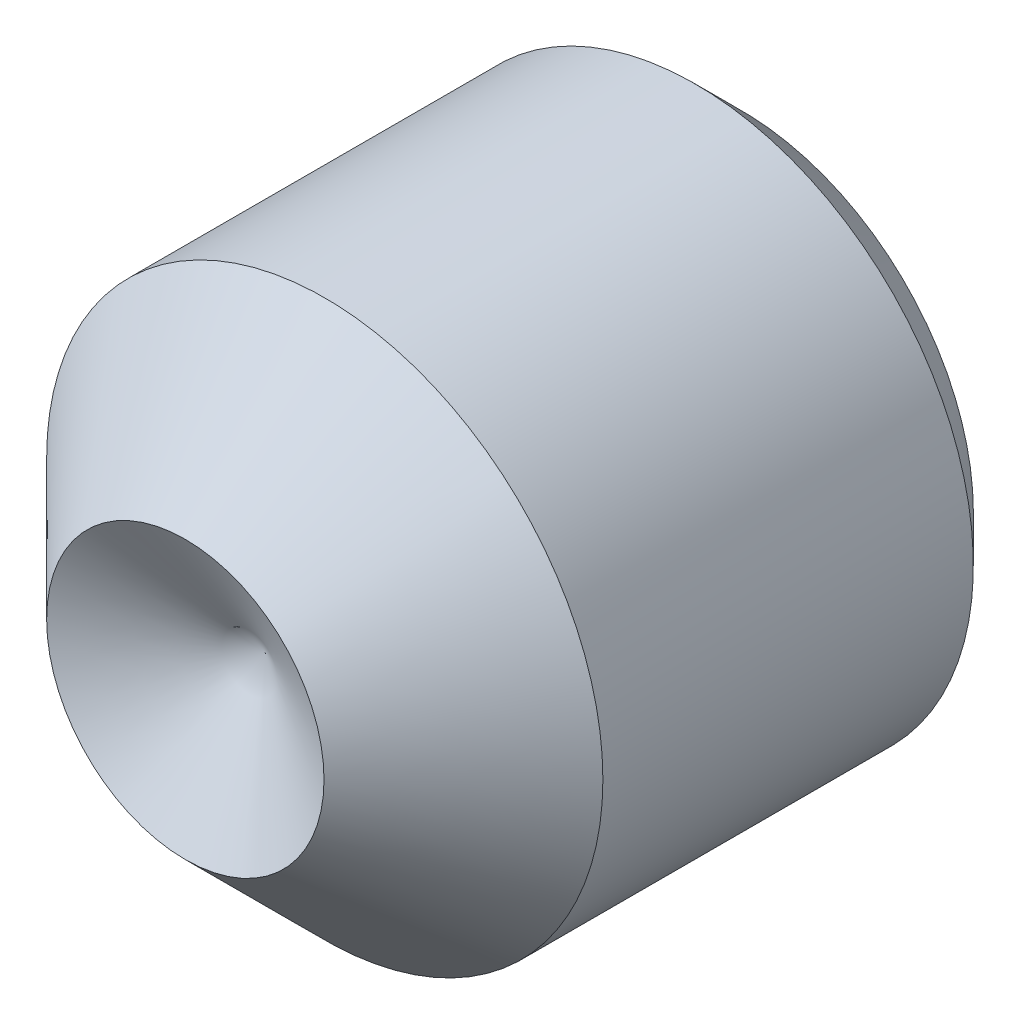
SolidWorks part; units mm, degrees
ref_plane "Front" through (0, 0, 0) normal (0, 0, 1) x (1, 0, 0)
ref_plane "Top" through (0, 0, 0) normal (0, 1, 0) x (1, 0, 0)
ref_plane "Right" through (0, 0, 0) normal (1, 0, 0) x (0, 0, -1)
sketch "Logo3_Revol_Axis" plane through (0, 0, 0) normal (0, 1, 0) x (1, 0, 0)
  line L0 (0, -43.5172) -> (0, 43.5172) construction
sketch "Logo3_bib1" plane through (0, 0, 0) normal (0, -1, 0) x (-1, 0, 0)
  line L0 (0, -9.525) -> (0, 0)
  line L1 (0, -9.525) -> (5, -9.525) construction
  line L2 (1.5875, 0) -> (1.5875, -9.525) construction
  line L3 (0, 0) -> (3.9687, 0)
  line L4 (4.7625, -0.7937) -> (4.7625, -8.7312)
  line L5 (1.5875, 0) -> (0, -1.5875) construction
  line L6 (0.7938, -0.7937) -> (4.7625, -0.7937) construction
  line L7 (4.7625, -0.7937) -> (3.9687, 0) construction
  line L8 (3.9687, 0) -> (4.7625, -0.7937)
  line L9 (3.9687, 0) -> (3.9687, -9.525) construction
  line L10 (0, 10.5852) -> (0, -63.2873) construction
  line L11 (3.9687, -9.525) -> (4.7625, -8.7312) construction
  line L12 (3.9687, -9.525) -> (0, -9.525)
  line L13 (4.7625, -8.7312) -> (3.9687, -9.525)
revolve "Revolve1" add sketch "Logo3_bib1" angle 360 about L10
sketch "Logo3_bib11" plane through (0, 0, 0) normal (0, 0, -1) x (1, 0, 0)
  line L1 (2.7496, 0) -> (1.3748, 2.3813)
  line L2 (1.3748, 2.3813) -> (-1.3748, 2.3813)
  line L3 (-1.3748, 2.3813) -> (-2.7496, 0)
  line L4 (-2.7496, 0) -> (-1.3748, -2.3813)
  line L5 (-1.3748, -2.3813) -> (1.3748, -2.3813)
  line L6 (1.3748, -2.3813) -> (2.7496, 0)
  circle A0 centre (0, 0) radius 2.3812 construction
  dimension "Logo3_key" = 4.7625
extrude "Cut-Extrude1" cut sketch "Logo3_bib11" against normal blind 2.5
sketch "Logo3_bib2" [suppressed] plane through (0, 0, 0) normal (0, 1, 0) x (1, 0, 0)
  line L0 (-3.1431, -30) -> (-3.1431, 0) construction
  line L1 (-4, -30) -> (0, -30) construction
  line L2 (0, 0) -> (-4, 0) construction
  line L3 (0, -43.5172) -> (0, 43.5172) construction
  line L4 (-5, -29) -> (0, -29) construction
  line L5 (-3.1431, -29) -> (-0.7675, -30)
  line L6 (0, -26.2867) -> (-4, -26.2867) construction
  line L11 (-4, 0) -> (-4, -30) construction
  line L12 (-4, -26.2867) -> (-5, -24.6806) construction
  line L13 (-5, -1) -> (-5, -29) construction
  line L15 (-5, -24.6806) -> (-7, -24.6806)
  line L16 (-7, -24.6806) -> (-7, -32.5)
  line L17 (-7, -32.5) -> (-0.7675, -32.5)
  line L18 (-5, -24.6806) -> (-4, -26.2867)
  line L19 (-4, -26.2867) -> (-3.1431, -26.2867)
  line L20 (-3.1431, -26.2867) -> (-3.1431, -29)
  line L21 (-0.7675, -30) -> (-0.7675, -32.5)
  line L22 (0, 0) -> (0, -32.5) construction
  dimension "D1" = 22.828
  dimension "D2" = 58.093
  dimension "D3" = 2
  dimension "logo3_d2" = 12
  dimension "logo3_l2" = 3.7133
  dimension "D4" = 2.5
revolve "Type2" [suppressed] cut sketch "Logo3_bib2" angle 360 about L0
sketch "Logo3_bib3" plane through (0, 0, 0) normal (0, 1, 0) x (1, 0, 0)
  line L0 (0, 0) -> (0, -9.525) construction
  line L1 (0, -9.525) -> (-5, -9.525) construction
  line L2 (2.3749, -9.525) -> (2.3749, -10.525) construction
  line L4 (-2.3749, -9.525) -> (-4.7625, -7.1374)
  line L5 (-4.7625, -0.7937) -> (-4.7625, -8.7312) construction
  line L6 (-4.7625, -7.1374) -> (-5.7625, -7.1374)
  line L7 (-5.7625, -7.1374) -> (-5.7625, -10.525)
  line L8 (-5.7625, -10.525) -> (0, -10.525)
  line L9 (0, 10.5852) -> (0, -63.2873) construction
  line L10 (-2.3749, -9.525) -> (0, -8.1539)
  line L12 (0, -8.1539) -> (0, -10.525)
  line L13 (-2.3749, -9.525) -> (-2.3749, -10.525) construction
  dimension "D1" = 30
  dimension "logo3_d2" = 4.7498
  dimension "D2" = 45
  dimension "D3" = 1
  dimension "D4" = 1
revolve "Type3" cut sketch "Logo3_bib3" angle 360 about L0
sketch "Logo3_bib4" [suppressed] plane through (0, 0, 0) normal (0, 1, 0) x (1, 0, 0)
  line L0 (0, 0) -> (0, -30) construction
  line L1 (-2.9915, 0) -> (-2.9915, -30) construction
  line L2 (0, 0) -> (-4, 0) construction
  line L3 (-4, -30) -> (0, -30) construction
  line L4 (-2.9915, -30) -> (-5, -27.8033)
  line L5 (-5, -1) -> (-5, -29) construction
  line L6 (-5, -27.8033) -> (-7.5117, -27.8033)
  line L7 (-7.5117, -27.8033) -> (-7.5117, -34.0728)
  line L8 (-7.5117, -34.0728) -> (-2.9915, -34.0728)
  line L9 (-2.9915, -34.0728) -> (-2.9915, -30)
  dimension "D1" = 47.562
  dimension "logo3_d2" = 12
  dimension "D2" = 2.5117
  dimension "D3" = 4.0728
revolve "Type4" [suppressed] cut sketch "Logo3_bib4" angle 360 about L0
equation "\"D2@Cosmetic Thread1\" = \"logo3_d1@Logo3_bib1\"-\"logo3_pas@Logo3_bib1\""
